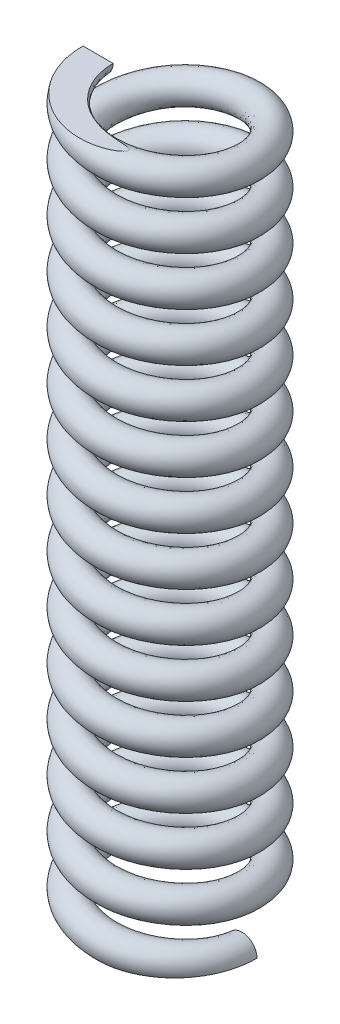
SolidWorks part; units mm, degrees
ref_plane "Front Plane" through (0, 0, 0) normal (0, 0, 1) x (1, 0, 0)
ref_plane "Top Plane" through (0, 0, 0) normal (0, 1, 0) x (1, 0, 0)
ref_plane "Right Plane" through (0, 0, 0) normal (1, 0, 0) x (0, 0, -1)
sketch "Sketch1" plane through (0, 0, 0) normal (0, 0, 1) x (1, 0, 0)
  line L0 (0, -16.889) -> (0, -6.2175)
  line L1 (1.3589, -6.2175) -> (-1.3589, -6.2175) construction
  line L2 (1.3589, -16.889) -> (-1.3589, -16.889) construction
sketch "Sketch2" plane through (0, 0, 0) normal (0, 0, 1) x (1, 0, 0)
  line L1 (0, -16.889) -> (0, -6.2175) construction
  circle A0 centre (-1.0922, -6.2175) radius 0.2286
  point P6 (-1.3208, -6.2175)
  dimension "D1" = 0.4572
  dimension "D2" = 1.3208
sweep "Sweep1" add profiles "Sketch2" path "Sketch1" parameters "D1"=5220
sketch "Sketch3" plane through (0, 0, 0) normal (0, 0, 1) x (1, 0, 0)
  line L1 (0, -16.889) -> (2.9339, -16.889)
  line L2 (0, -16.889) -> (0, -18.5195)
  line L3 (0, -18.5195) -> (2.9339, -18.5195)
  line L4 (2.9339, -16.889) -> (2.9339, -18.5195)
  line L5 (0, 5.3893) -> (2.5639, 5.3893)
  line L6 (0, 5.3893) -> (0, -6.2175)
  line L7 (0, -6.2175) -> (2.5639, -6.2175)
  line L8 (2.5639, 5.3893) -> (2.5639, -6.2175)
  dimension "D1" = 1.6305
revolve "Cut-Revolve1" cut sketch "Sketch3" angle 360 about L0
sketch "Sketch4" plane through (0, 0, 0) normal (0, 1, 0) x (1, 0, 0)
  circle A0 centre (0, 0) radius 3.0674 construction
